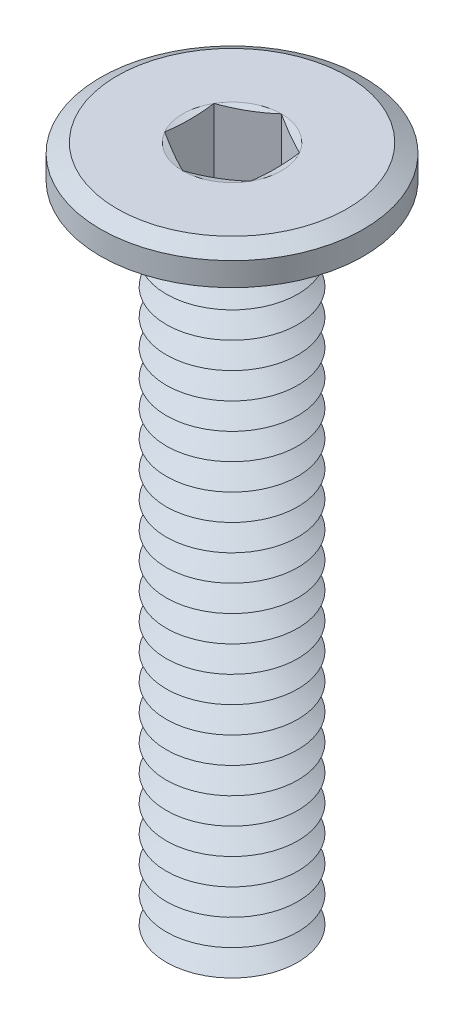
SolidWorks part; units mm, degrees
ref_plane "Front Plane" through (0, 0, 0) normal (0, 0, 1) x (1, 0, 0)
ref_plane "Top Plane" through (0, 0, 0) normal (0, 1, 0) x (1, 0, 0)
ref_plane "Right Plane" through (0, 0, 0) normal (1, 0, 0) x (0, 0, -1)
sketch "Sketch1" plane through (0, 0, 0) normal (0, 1, 0) x (1, 0, 0)
  circle A0 centre (0, 0) radius 2
  dimension "D1" = 4
extrude "Boss-Extrude1" add sketch "Sketch1" against normal blind 0.5
sketch "Sketch2" plane through (0, -0.5, 0) normal (0, -1, 0) x (1, 0, 0)
  circle A0 centre (0, 0) radius 1
  dimension "D1" = 2
extrude "Boss-Extrude2" add sketch "Sketch2" along normal blind 10
sketch "Sketch3" plane through (0, 0, 0) normal (1, 0, 0) x (0, 0, -1)
  line L0 (0, 0.9906) -> (0, -8.2999) construction
sketch "Sketch5" plane through (0, 0, 0) normal (1, 0, 0) x (0, 0, -1)
  line L0 (-1, -10.7) -> (-0.6536, -10.5)
  line L1 (-1, -0.5) -> (-1, -10.5) construction
  line L2 (-0.6536, -10.5) -> (-1, -10.3)
  line L3 (-1, -0.5) -> (-1, -10.5) construction
  line L4 (-1, -10.3) -> (-1, -10.7)
  line L6 (-1, -0.5) -> (-1, -10.5) construction
  line L7 (-1, -0.5) -> (-1, -10.5) construction
  line L14 (-1, -10.5) -> (1, -10.5) construction
  dimension "D1" = 0.4
revolve "Cut-Revolve1" cut sketch "Sketch5" angle 360 about L0
pattern_linear "LPattern1" count 24 spacing 0.4 along (0, 1, 0) of "Cut-Revolve1"
fillet "Fillet1" radius 0.1 1 edges at (0, -0.5, -1)
chamfer "Chamfer2" distance 0.25 angle 30 1 edges at (0, 0, 2)
sketch "Sketch6" plane through (0, 0, 0) normal (0, 1, 0) x (1, 0, 0)
  line L1 (0, 0.7506) -> (-0.65, 0.3753)
  line L2 (-0.65, 0.3753) -> (-0.65, -0.3753)
  line L3 (-0.65, -0.3753) -> (0, -0.7506)
  line L4 (0, -0.7506) -> (0.65, -0.3753)
  line L5 (0.65, -0.3753) -> (0.65, 0.3753)
  line L6 (0.65, 0.3753) -> (0, 0.7506)
  circle A0 centre (0, 0) radius 0.65 construction
  dimension "D1" = 1.3
extrude "Cut-Extrude1" cut sketch "Sketch6" against normal blind 1.2
sketch "Sketch7" plane through (0, -1.2, 0) normal (0, 1, 0) x (1, 0, 0)
  line L0 (-0.65, 0.3753) -> (-0.65, -0.3753) construction
  circle A0 centre (0, 0) radius 0.65
extrude "Cut-Extrude2" cut sketch "Sketch7" against normal through all draft 60
sketch "Sketch8" plane through (0, 0, 0) normal (0, 1, 0) x (1, 0, 0)
  circle A0 centre (0, 0) radius 0.7506
extrude "Cut-Extrude3" cut sketch "Sketch8" against normal through all draft 75
